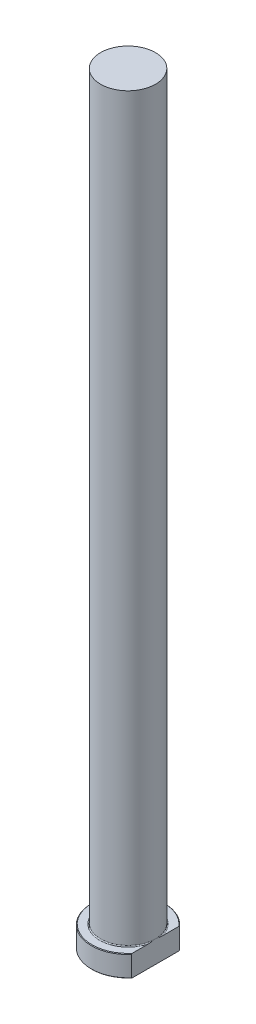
SolidWorks part; units mm, degrees
ref_plane "Front Plane" through (0, 0, 0) normal (0, 0, 1) x (1, 0, 0)
ref_plane "Top Plane" through (0, 0, 0) normal (0, 1, 0) x (1, 0, 0)
ref_plane "Right Plane" through (0, 0, 0) normal (1, 0, 0) x (0, 0, -1)
sketch "Sketch1" plane through (0, 0, 0) normal (0, 0, 1) x (1, 0, 0)
  line L0 (0, 259.9588) -> (0, -15.1925) construction
  line L1 (0, 0) -> (-12, 0)
  line L2 (-12, 0) -> (-12, 7)
  line L3 (-12, 7) -> (-9, 7)
  line L4 (-9, 7) -> (-9, 250)
  line L5 (-9, 250) -> (0, 250)
  line L6 (0, 250) -> (0, 0)
  dimension "L" = 250
  dimension "H" = 24
  dimension "T" = 7
  dimension "D" = 18
revolve "Revolve1" add sketch "Sketch1" angle 360 about L0
chamfer "Chamfer1" distance 0.2 angle 45 2 edges at (0, 7, 12) (0, 0, 12)
fillet "Fillet1" radius 0.3 1 edges at (0, 7, 9)
sketch "Sketch2" plane through (0, 0, 0) normal (0, 1, 0) x (1, 0, 0)
  line L0 (9, 7.9373) -> (9, -7.9373)
  circle A0 centre (0, 0) radius 12 construction
  arc A1 (9, -7.9373) -> (9, 7.9373) centre (0, 0) ccw
  circle A2 centre (0, 0) radius 9 construction
extrude "KEY" cut sketch "Sketch2" along normal through all
